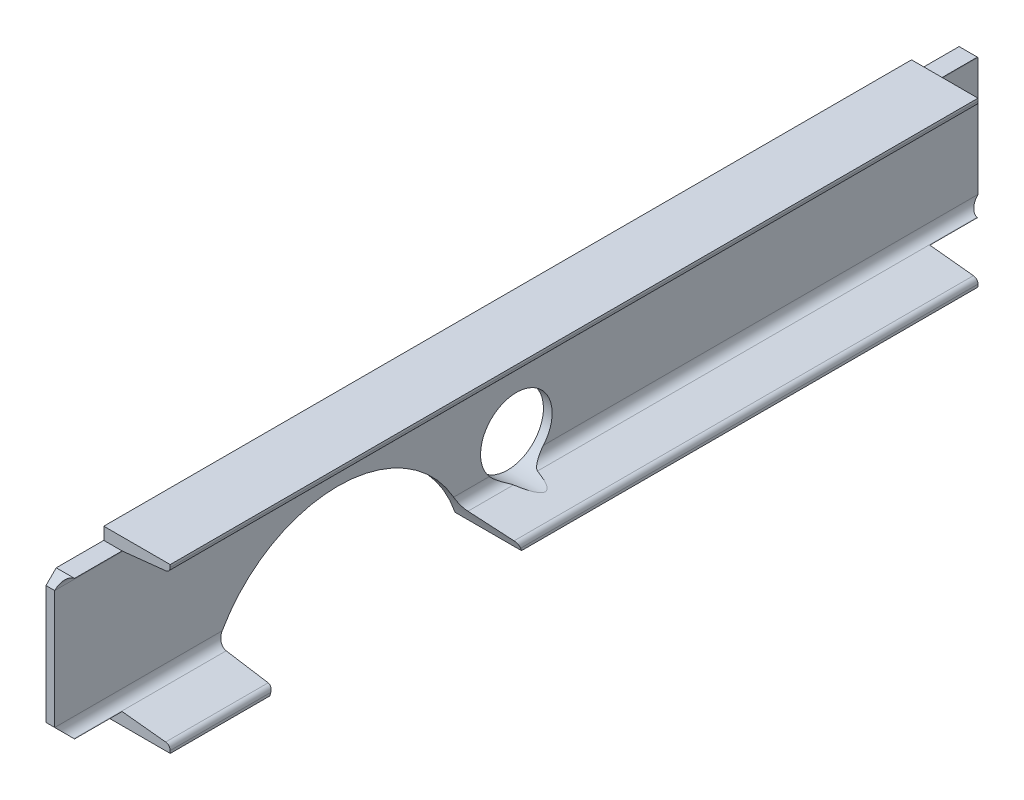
SolidWorks part; units mm, degrees
ref_plane "前视基准面" through (0, 0, 0) normal (0, 0, 1) x (1, 0, 0)
ref_plane "上视基准面" through (0, 0, 0) normal (0, 1, 0) x (1, 0, 0)
ref_plane "右视基准面" through (0, 0, 0) normal (1, 0, 0) x (0, 0, -1)
sketch "草图1" plane through (0, 0, 0) normal (0, 0, 1) x (1, 0, 0)
  line L0 (65, 80) -> (0, 80)
  line L1 (0, 80) -> (0, -80)
  line L2 (0, -80) -> (65, -80)
  line L3 (65, -80) -> (65, -77.4971)
  line L4 (60.528, -72.5251) -> (17.444, -67.9498)
  line L5 (8.5, -58.0057) -> (8.5, 58.0057)
  line L6 (17.444, 67.9498) -> (60.528, 72.5251)
  line L7 (65, 77.4971) -> (65, 80)
  line L8 (36.75, 80) -> (36.75, 70) construction
  line L9 (36.75, -70) -> (36.75, -80) construction
  arc A0 (8.5, 58.0057) -> (17.444, 67.9498) centre (18.5, 58.0057) cw
  arc A1 (17.444, -67.9498) -> (8.5, -58.0057) centre (18.5, -58.0057) cw
  arc A2 (60.528, 72.5251) -> (65, 77.4971) centre (60, 77.4971) ccw
  arc A3 (65, -77.4971) -> (60.528, -72.5251) centre (60, -77.4971) ccw
  point P19 (65, 73)
  point P22 (65, -73)
  dimension "D11" = 10
  dimension "D12" = 5
  dimension "D1" = 8.5
  dimension "D2" = 7
  dimension "D3" = 7
  dimension "D4" = 160
  dimension "D5" = 65
  dimension "D6" = 65
  dimension "D7" = 80
  dimension "D8" = 28.25
  dimension "D9" = 10
  dimension "D10" = 10
extrude "拉伸1" add sketch "草图1" along normal mid plane 903
sketch "草图2" plane through (0, 0, 451.5) normal (0, 0, 1) x (1, 0, 0)
  line L0 (0, 80) -> (0, -80) construction
  line L1 (65, 80) -> (0, 80)
  line L2 (65, 80) -> (65, 68)
  line L3 (65, 68) -> (0, 68)
  line L4 (0, 80) -> (0, 68)
  line L6 (65, -80) -> (0, -80)
  line L7 (65, -80) -> (65, -68)
  line L8 (65, -68) -> (0, -68)
  line L9 (0, -80) -> (0, -68)
  dimension "D1" = 12
  dimension "D2" = 12
extrude "切除-拉伸1" cut sketch "草图2" against normal blind 56.5
mirror "镜向1" about plane through (0, 0, 0) normal (0, 0, 1) of "切除-拉伸1"
sketch "草图3" plane through (0, 0, 0) normal (-1, 0, 0) x (0, 0, 1)
  line L0 (51.4715, -80) -> (297.5285, -80)
  line L1 (395, -80) -> (-395, -80) construction
  line L2 (451.5, 68) -> (451.5, -68) construction
  arc A0 (297.5285, -80) -> (51.4715, -80) centre (174.5, -122) ccw
  dimension "D1" = 260
  dimension "D3" = 277
  dimension "D2" = 88
extrude "切除-拉伸2" cut sketch "草图3" against normal through all
sketch "草图4" plane through (0, 0, 0) normal (-1, 0, 0) x (0, 0, 1)
  line L0 (51.4715, -80) -> (-395, -80) construction
  line L1 (-451.5, 68) -> (-451.5, -68) construction
  circle A0 centre (0, -35) radius 35
  dimension "D1" = 70
  dimension "D2" = 45
  dimension "D3" = 451.5
extrude "切除-拉伸3" cut sketch "草图4" against normal through all
chamfer "倒角1" distance 10 angle 45 4 edges at (8.9583, -68, -451.5) (8.9583, 68, -451.5) (8.9583, -68, 451.5) (8.9583, 68, 451.5)
